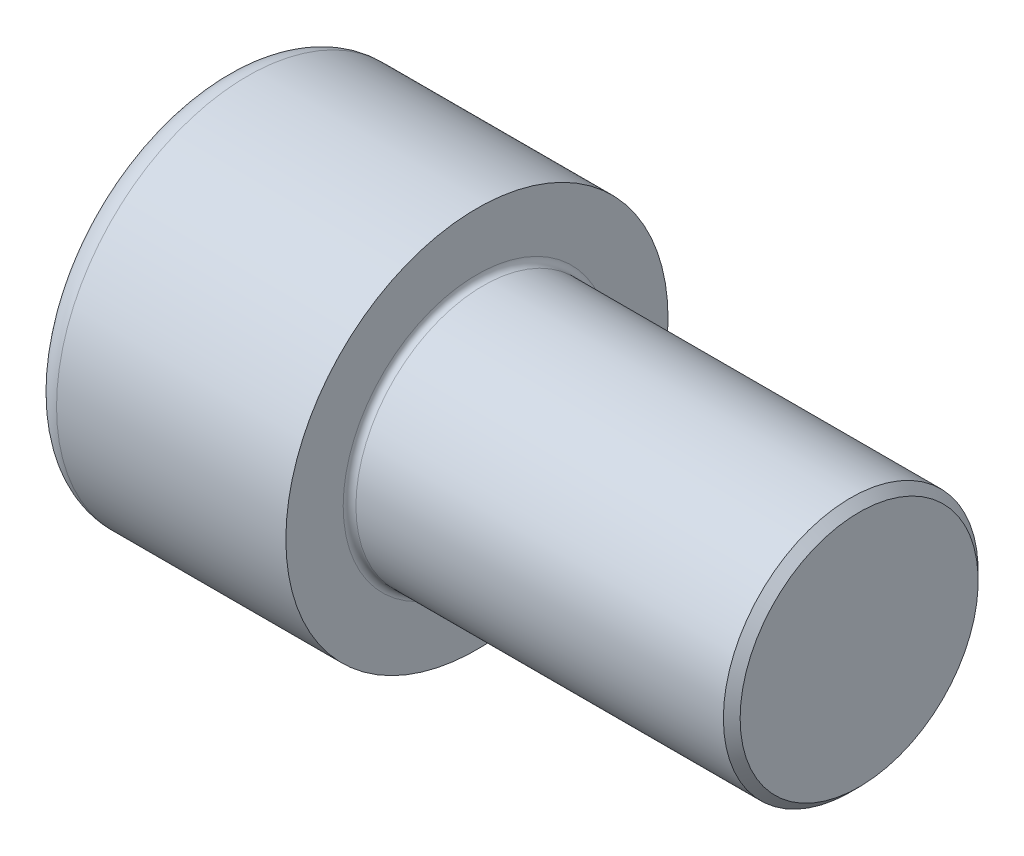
SolidWorks part; units mm, degrees
ref_plane "Plane1" through (0, 0, 0) normal (0, 0, 1) x (1, 0, 0)
ref_plane "Plane2" through (0, 0, 0) normal (0, 1, 0) x (1, 0, 0)
ref_plane "Plane3" through (0, 0, 0) normal (1, 0, 0) x (0, 0, -1)
revolve "Base-Revolve" add sketch "BodySke"
sketch "BodySke" plane through (0, 0, 0) normal (0, 0, 1) x (1, 0, 0)
  line L0 (0, 0) -> (0, 75)
  line L1 (0, 75) -> (100, 75)
  line L2 (100, 75) -> (100, 50)
  line L3 (100, 50) -> (246.7125, 50)
  line L4 (250, 46.7125) -> (250, 0)
  line L5 (250, 0) -> (0, 0)
  line L6 (-31.75, 0) -> (127, 0) construction
  line L8 (250, 46.7125) -> (246.7125, 50)
  line L10 (250, -46.7125) -> (246.7125, -50) construction
  line L11 (106, 9.525) -> (106, 3.175) construction
  line L12 (100, 9.525) -> (100, 3.175) construction
  line L13 (190, 9.525) -> (190, 3.175) construction
  dimension "Diameter" = 100
  dimension "Head_ht" = 100
  dimension "Length" = 150
  dimension "Body_ch_ang" = 45
  dimension "Head_dia" = 150
  dimension "Minor_dia" = 93.425
  dimension "Advance" = 6
  dimension "Thread_nom" = 150
  dimension "Thread_length" = 60
fillet "Fillet1" radius 2.5 1 edges at (100, 0, 50)
fillet "Fillet2" radius 10 1 edges at (0, 0, 75)
sketch "Sketch2" plane through (0, 0, 0) normal (0, 0, 1) x (1, 0, 0)
  line L0 (0, 42.56) -> (60, 42.56)
  line L1 (60, 42.56) -> (84.572, 0)
  line L2 (-31.75, 0) -> (127, 0) construction
  line L3 (84.572, 0) -> (0, 0)
  line L4 (0, 0) -> (0, 42.56)
  line L6 (0, 0) -> (47.625, 0) construction
  dimension "D1" = 42.56
  dimension "D2" = 60
  dimension "Depth" = 60
revolve "Hex-PreBroach" cut sketch "Sketch2" angle 360 about L6
sketch "Sketch3" plane through (0, 0, 0) normal (-1, 0, 0) x (0, 0.5, 0.866)
  line L0 (24.572, 42.56) -> (-24.572, 42.56)
  line L1 (-24.572, 42.56) -> (-49.1441, 0)
  line L2 (24.572, 42.56) -> (49.1441, 0)
  line L3 (24.572, -42.56) -> (49.1441, 0)
  line L4 (24.572, -42.56) -> (-24.572, -42.56)
  line L5 (-24.572, -42.56) -> (-49.1441, 0)
  dimension "D1" = 42.56
  dimension "D2" = 42.56
  dimension "Hex_size" = 85.12
extrude "Hex" cut sketch "Sketch3" against normal blind 60
sketch "ThdSchSke" plane through (0, 0, 0) normal (0, 0, 1) x (1, 0, 0)
  line L0 (118, -46.7125) -> (115.6981, -50)
  line L1 (118, -46.7125) -> (120.3019, -50)
  line L2 (120.3019, -50) -> (120.3019, -62.5)
  line L3 (-3.175, 0) -> (5.1513, 0) construction
  line L4 (0, 65) -> (0, -65) construction
  line L5 (120.3019, -62.5) -> (115.6981, -62.5)
  line L6 (115.6981, -62.5) -> (115.6981, -50)
  dimension "Thread_minor" = 93.425
  dimension "Diameter" = 100
  dimension "Start" = 118
  dimension "SideAngle" = 55
  dimension "VeeAngle" = 70
  dimension "Overcut" = 125
revolve "ThreadSchematic" cut sketch "ThdSchSke" angle 360 about L3
pattern_linear "ThdSchPat"
equation "\"D2@Sketch3\" = \"Hex_size@Sketch3\" / 2"
equation "\"D1@Sketch3\" = \"Hex_size@Sketch3\" / 2"
equation "\"D1@Sketch2\" = \"Hex_size@Sketch3\" / 2"
equation "\"Thread_minor@ThreadCosmetic\"  =  \"Minor_dia@BodySke\""
equation "\"Depth@Sketch2\" =  \"Key_eng@Hex\""
equation "\"Thread_length@ThreadCosmetic\" = ((sgn( (\"Length@BodySke\" - \"Advance@BodySke\" * 3.0) - \"Thread_nom@BodySke\" )-1)*( (\"Length@BodySke\" - \"Advance@BodySke\" * 3.0) - \"Thread_nom@BodySke\" ))/-2+ \"Thread_no"
equation "\"Thread_minor@ThdSchSke\" = \"Minor_dia@BodySke\""
equation "\"Diameter@ThdSchSke\" = \"Diameter@BodySke\""
equation "\"Overcut@ThdSchSke\" = \"Diameter@BodySke\" * 1.25"
equation "\"Start@ThdSchSke\" = \"Head_ht@BodySke\" + \"Length@BodySke\" - \"Thread_length@ThreadCosmetic\"  '---Non-countersunk---"
equation "\"Num_threads@ThdSchPat\" = int( \"Thread_length@ThreadCosmetic\" / \"Advance@BodySke\" + 0.999 )  + 1"
equation "\"Advance@ThdSchPat\" = \"Thread_length@ThreadCosmetic\" /  (\"Num_threads@ThdSchPat\" - 1) 'relax it"
equation "\"Num_threads@ThdSchPat\" = \"Num_threads@ThdSchPat\" - sgn( \"Num_threads@ThdSchPat\" - 1) '---chamfered tips only---"
